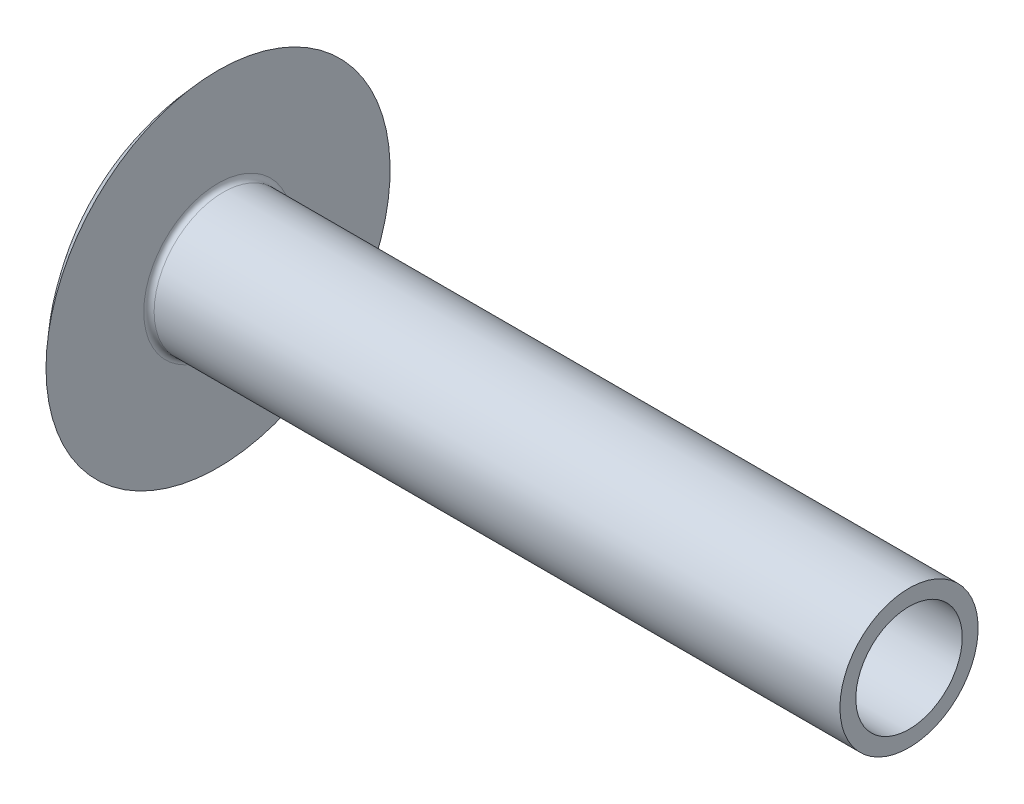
SolidWorks part; units mm, degrees
ref_plane "Front" through (0, 0, 0) normal (0, 0, 1) x (1, 0, 0)
ref_plane "Top" through (0, 0, 0) normal (0, 1, 0) x (1, 0, 0)
ref_plane "Right" through (0, 0, 0) normal (1, 0, 0) x (0, 0, -1)
other "Configuration Table"
sketch "Sketch1" plane through (0, 0, 0) normal (0, 0, 1) x (1, 0, 0)
  line L0 (-60.0944, 0) -> (17.9503, 0) construction
  line L1 (43.962, 0) -> (43.962, 4)
  line L2 (43.962, 4) -> (4.262, 4)
  line L3 (3.962, 4.3) -> (3.962, 9.96)
  line L4 (43.962, 0) -> (0, 0)
  arc A0 (3.962, 9.96) -> (0, 0) centre (14.5, 0) ccw
  arc A1 (4.262, 4) -> (3.962, 4.3) centre (4.262, 4.3) cw
  dimension "R" = 14.5
  dimension "r1" = 0.3
  dimension "d" = 8
  dimension "dk" = 19.92
  dimension "l" = 40
revolve "Base-Revolve" add sketch "Sketch1" angle 360 about L0
sketch "Sketch2" plane through (0, 0, 0) normal (0, 0, 1) x (1, 0, 0)
  line L0 (2.2377, 0) -> (-30.0312, 0) construction
  line L2 (43.962, 0) -> (43.962, 3.08)
  line L4 (43.962, 3.08) -> (36.312, 3.08)
  line L5 (36.312, 3.08) -> (34.0743, 0)
  line L6 (43.962, 0) -> (34.0743, 0)
  line L7 (43.962, -4) -> (43.962, 4) construction
  dimension "D1" = 54
  dimension "dt" = 6.16
  dimension "t" = 7.65
revolve "Cut-Revolve1" cut sketch "Sketch2" angle 360 about L0
